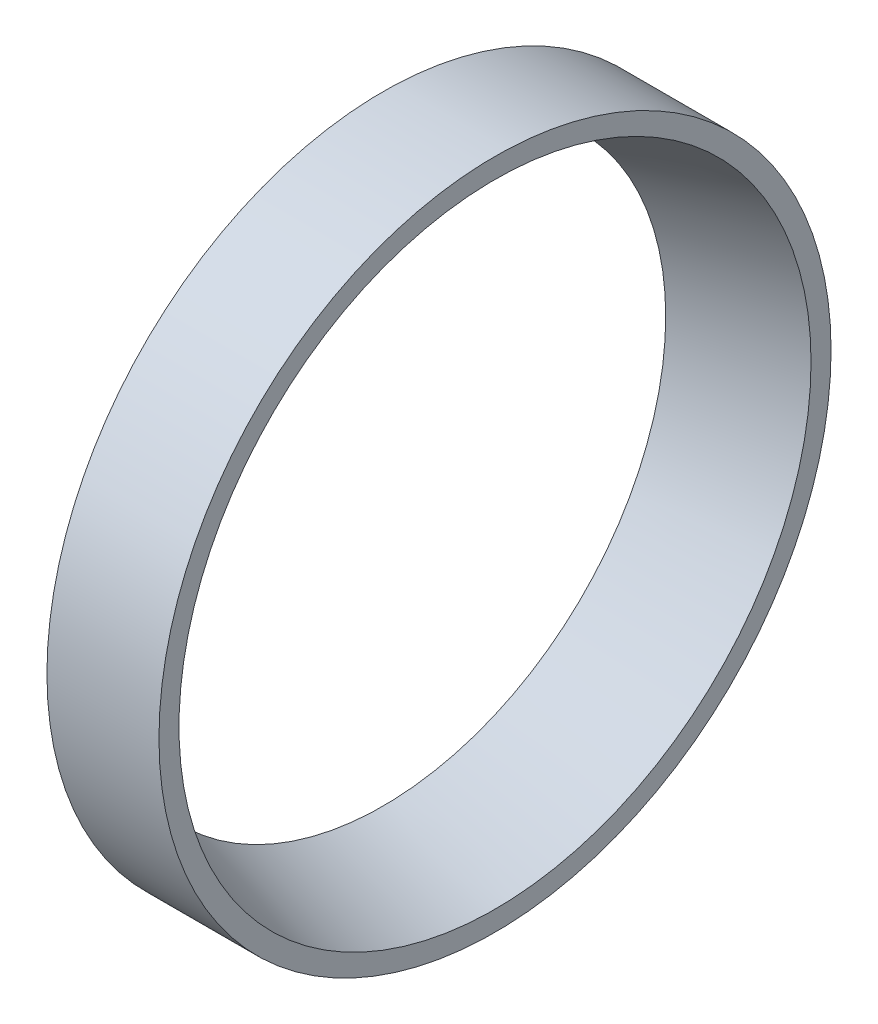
SolidWorks part; units mm, degrees
ref_plane "Plan1" through (0, 0, 0) normal (0, 0, 1) x (1, 0, 0)
ref_plane "Plan2" through (0, 0, 0) normal (0, 1, 0) x (1, 0, 0)
ref_plane "Plan3" through (0, 0, 0) normal (1, 0, 0) x (0, 0, -1)
sketch "Esquisse1" plane through (0, 0, 0) normal (0, 0, 1) x (1, 0, 0)
  line L0 (0, 28.212) -> (0, 30)
  line L1 (0, 30) -> (-10, 30)
  line L2 (-10, 30) -> (-10, 25.24)
  line L3 (-10, 25.24) -> (0, 28.212)
  line L4 (40, 0) -> (-40, 0) construction
  dimension "D1" = 1.788
  dimension "D2" = 10
  dimension "D3" = 4.76
  dimension "D4" = 30
revolve "Base-Révolution" add sketch "Esquisse1" angle 360 about L4
